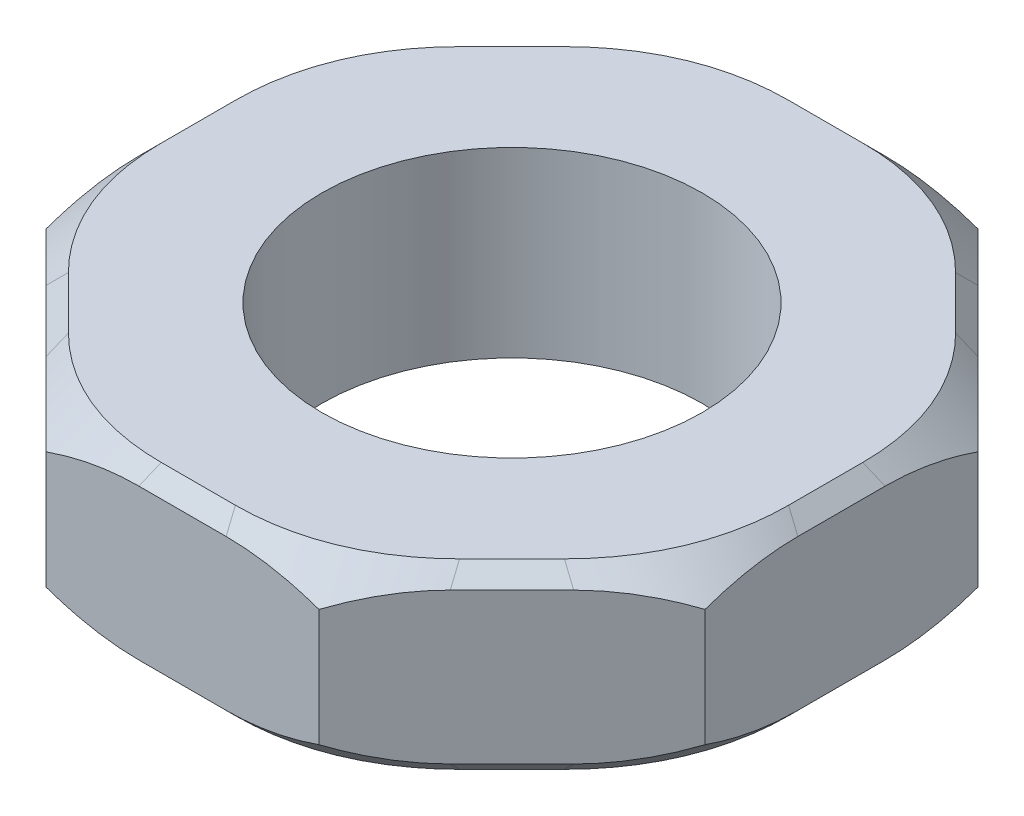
SolidWorks part; units mm, degrees
ref_plane "Plan de face" through (0, 0, 0) normal (0, 0, 1) x (1, 0, 0)
ref_plane "Plan de dessus" through (0, 0, 0) normal (0, 1, 0) x (1, 0, 0)
ref_plane "Plan de droite" through (0, 0, 0) normal (1, 0, 0) x (0, 0, -1)
sketch "Esquisse2" plane through (0, 0, 0) normal (0, 1, 0) x (1, 0, 0)
  line L0 (0, 67.2648) -> (0, -58.4811) construction
  line L1 (-20.785, 8.6094) -> (-20.785, -8.6094)
  line L2 (61.7172, 0) -> (-61.7172, 0) construction
  line L3 (-20.785, 8.6094) -> (-8.6094, 20.785)
  line L4 (-8.6094, 20.785) -> (8.6094, 20.785)
  line L5 (20.785, 8.6094) -> (8.6094, 20.785)
  line L6 (20.785, 8.6094) -> (20.785, -8.6094)
  line L7 (20.785, -8.6094) -> (8.6094, -20.785)
  line L8 (-8.6094, -20.785) -> (8.6094, -20.785)
  line L9 (-20.785, -8.6094) -> (-8.6094, -20.785)
  circle A0 centre (0, 0) radius 12
  point P12 (0, 20.785)
  point P14 (0, -20.785)
  point P16 (20.785, 0)
  point P19 (-20.785, 0)
  dimension "D5" = 24
  dimension "D1" = 41.57
  dimension "D2" = 41.57
  dimension "D3" = 41.57
extrude "Extrusion1" add sketch "Esquisse2" along normal blind 11.5
chamfer "Chanfrein2" distance 1 angle 45 16 edges at (-20.785, 0, 0) (-14.6972, 0, -14.6972) (0, 0, -20.785) (14.6972, 0, -14.6972) (20.785, 0, 0) (14.6972, 0, 14.6972) (0, 0, 20.785) (-14.6972, 0, 14.6972) (0, 11.5, 20.785) (14.6972, 11.5, 14.6972) (20.785, 11.5, 0) (14.6972, 11.5, -14.6972) (0, 11.5, -20.785) (-14.6972, 11.5, -14.6972) (-20.785, 11.5, 0) (-14.6972, 11.5, 14.6972)
fillet "Congé1" radius 20 16 edges at (8.4023, 11, 20.285) (20.285, 11, 8.4023) (20.285, 11, -8.4023) (8.4023, 11, -20.285) (-8.4023, 11, -20.285) (-20.285, 11, -8.4023) (-20.285, 11, 8.4023) (-8.4023, 11, 20.285) (8.4023, 0.5, -20.285) (20.285, 0.5, -8.4023) (20.285, 0.5, 8.4023) (8.4023, 0.5, 20.285) (-8.4023, 0.5, 20.285) (-20.285, 0.5, 8.4023) (-20.285, 0.5, -8.4023) (-8.4023, 0.5, -20.285)
